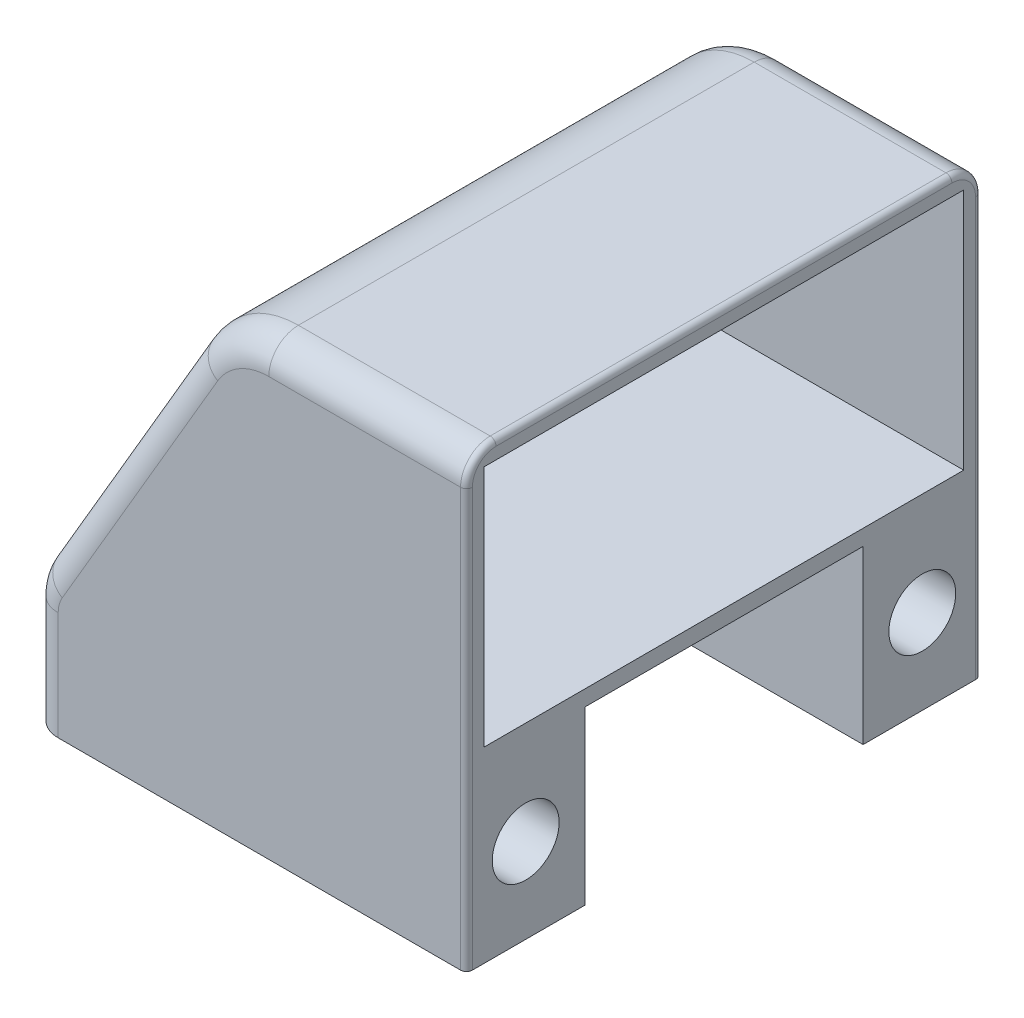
SolidWorks part; units mm, degrees
ref_plane "Plan de face" through (0, 0, 0) normal (0, 0, 1) x (1, 0, 0)
ref_plane "Plan de dessus" through (0, 0, 0) normal (0, 1, 0) x (1, 0, 0)
ref_plane "Plan de droite" through (0, 0, 0) normal (1, 0, 0) x (0, 0, -1)
sketch "Esquisse1" plane through (0, 0, 0) normal (0, 0, 1) x (1, 0, 0)
  line L0 (-42, 47) -> (-69.5, 0)
  line L1 (0, 0) -> (-69.5, 0)
  line L2 (0, 0) -> (0, 47)
  line L3 (0, 47) -> (-42, 47)
  dimension "D1" = 42
  dimension "D2" = 47
  dimension "D3" = 69.5
extrude "Boss.-Extru.1" add sketch "Esquisse1" along normal blind 87
shell "Coque1" thickness 3
sketch "Esquisse2" plane through (0, 0, 87) normal (0, 0, 1) x (1, 0, 0)
  line L0 (0, 0) -> (0, -7.65)
  line L2 (-69.5, 0) -> (-73.9761, -7.65)
  line L3 (-42, 47) -> (-69.5, 0) construction
  line L4 (-69.5, 0) -> (0, 0)
  line L5 (0, -7.65) -> (0, -28.65)
  line L6 (0, -28.65) -> (-73.9761, -28.65)
  line L7 (-73.9761, -28.65) -> (-73.9761, -7.65)
  dimension "D1" = 7.65
  dimension "D2" = 21
  dimension "D3" = 21
extrude "Boss.-Extru.2" add sketch "Esquisse2" along normal up to surface (87 mm away)
sketch "Esquisse3" plane through (0, 0, 0) normal (1, 0, 0) x (0, 0, -1)
  line L0 (0, -28.65) -> (-87, -28.65) construction
  line L1 (-67, -28.65) -> (-20, -28.65)
  line L2 (-67, -28.65) -> (-67, 0.35)
  line L3 (-67, 0.35) -> (-20, 0.35)
  line L4 (-20, -28.65) -> (-20, 0.35)
  line L5 (-87, -28.65) -> (-87, 47) construction
  dimension "D1" = 47
  dimension "D2" = 29
  dimension "D3" = 20
extrude "Enlèv. mat.-Extru.1" cut sketch "Esquisse3" against normal blind 49.5
sketch "Esquisse4" plane through (-49.5, 0, 0) normal (1, 0, 0) x (0, 0, -1)
  line L0 (-20, -28.65) -> (-20, 0.35) construction
  line L1 (-20, 0.35) -> (-67, 0.35)
  line L2 (-20, 0.35) -> (-20, -25.65)
  line L3 (-20, -25.65) -> (-67, -25.65)
  line L4 (-67, 0.35) -> (-67, -25.65)
  line L5 (-20, 0.35) -> (-67, 0.35) construction
  line L6 (-67, 0.35) -> (-67, -28.65) construction
  line L7 (-67, -28.65) -> (-20, -28.65) construction
  dimension "D1" = 3
extrude "Enlèv. mat.-Extru.2" cut sketch "Esquisse4" against normal blind 17.5
sketch "Esquisse5" plane through (0, 0, 0) normal (1, 0, 0) x (0, 0, -1)
  line L0 (0, -28.65) -> (-20, -28.65) construction
  line L3 (0, -28.65) -> (0, 47) construction
  line L4 (-87, -28.65) -> (-87, 47) construction
  circle A0 centre (-77, -14.33) radius 5.65
  circle A1 centre (-10, -14.33) radius 5.65
  dimension "D2" = 11.3
  dimension "D1" = 14.32
  dimension "D3" = 10
  dimension "D4" = 10
extrude "Enlèv. mat.-Extru.3" cut sketch "Esquisse5" against normal blind 66.4
fillet "Congé1" radius 15 1 edges at (-42, 47, 43.5)
fillet "Congé2" radius 10 1 edges at (-73.9761, -7.65, 43.5)
fillet "Congé3" radius 5 10 edges at (-16.6988, 47, 0) (-40.8599, 45.0121, 0) (-59.4757, 17.1324, 0) (-73.6278, -7.7444, 0) (-73.9761, -19.5053, 87) (-73.9761, -19.5053, 0) (-73.6278, -7.7444, 87) (-59.4757, 17.1324, 87) (-40.8599, 45.0121, 87) (-16.6988, 47, 87)
fillet "Congé4" radius 10 1 edges at (-40.2795, 44, 43.5)
fillet "Congé5" radius 1 5 edges at (0, 6.675, 0) (0, 45.5355, 1.4645) (0, 47, 43.5) (0, 45.5355, 85.5355) (0, 6.675, 87)
